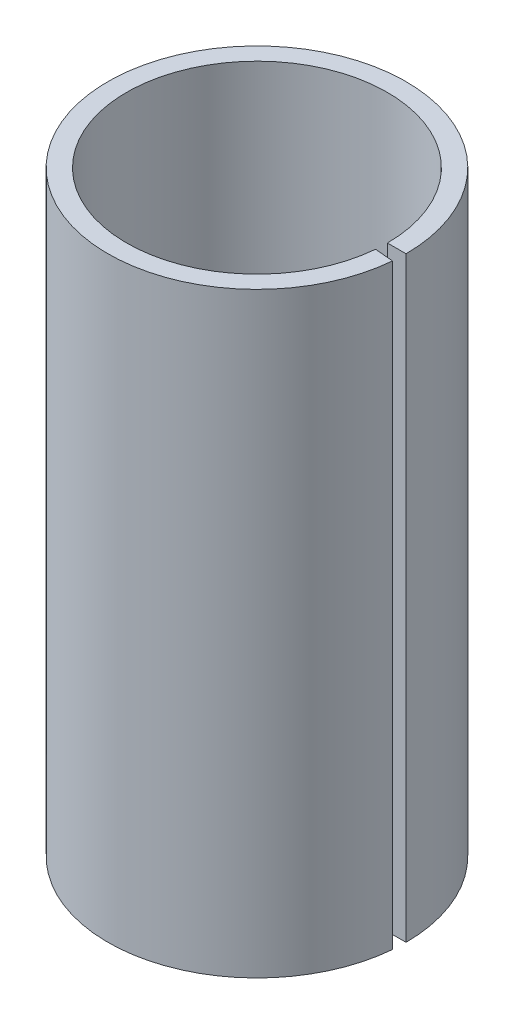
SolidWorks part; units mm, degrees
ref_plane "Front Plane" through (0, 0, 0) normal (0, 0, 1) x (1, 0, 0)
ref_plane "Top Plane" through (0, 0, 0) normal (0, 1, 0) x (1, 0, 0)
ref_plane "Right Plane" through (0, 0, 0) normal (1, 0, 0) x (0, 0, -1)
sketch "Sketch1" plane through (0, 0, 0) normal (0, 0, 1) x (1, 0, 0)
  line L0 (0, -10.8842) -> (0, 26.586) construction
  line L1 (4, -0.1198) -> (4, 15.8802)
  line L2 (4, 15.8802) -> (3.5, 15.8802)
  line L3 (3.5, 15.8802) -> (3.5, -0.1198)
  line L4 (3.5, -0.1198) -> (4, -0.1198)
  dimension "D1" = 8
  dimension "D2" = 0.5
  dimension "D3" = 16
revolve "Revolve1" add sketch "Sketch1" angle 355 about L0
